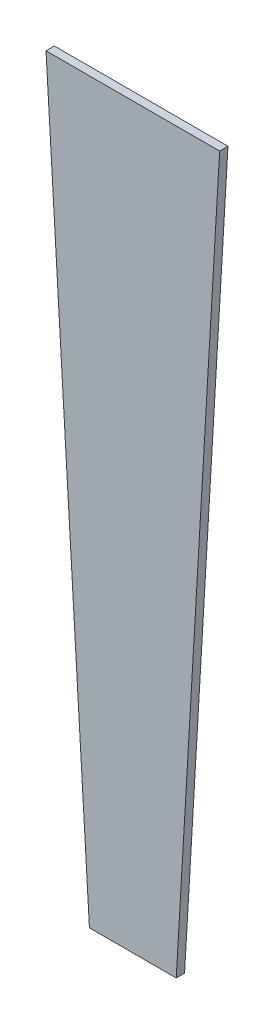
SolidWorks part; units mm, degrees
ref_plane "Front Plane" through (0, 0, 0) normal (0, 0, 1) x (1, 0, 0)
ref_plane "Top Plane" through (0, 0, 0) normal (0, 1, 0) x (1, 0, 0)
ref_plane "Right Plane" through (0, 0, 0) normal (1, 0, 0) x (0, 0, -1)
sketch "Sketch1" plane through (0, 0, 0) normal (0, 0, 1) x (1, 0, 0)
  line L0 (0, 0) -> (-25.4, 0)
  line L1 (-25.4, 0) -> (-19.05, -107.95)
  line L2 (-19.05, -107.95) -> (-6.35, -107.95)
  line L3 (-6.35, -107.95) -> (0, 0)
  point P3 (-12.7, 0)
  point P6 (-12.7, -107.95)
  dimension "D1" = 25.4
  dimension "D2" = 12.7
  dimension "D3" = 107.95
base flange "Base-Flange1" sketch "Sketch1" thickness 1.2192 reverse thickness direction no parameters "D1"=0.7366
sketch "Bend-Lines1" [suppressed] plane through (0, 0, 0) normal (0, 1, 0) x (1, 0, 0)
sketch "Bounding-Box1" [suppressed] plane through (0, 0, 0) normal (0, 1, 0) x (1, 0, 0)
sheet metal parameters "Sheet-Metal1" thickness 1.2192 parameters "D1"=0.7366
flat pattern "Flat-Pattern1"
sketch "Bend-Lines2" plane through (0, 0, 0) normal (0, 1, 0) x (1, 0, 0)
sketch3d "Bounding-Box2" [suppressed]
  line L0 (0, 0, 0) -> (0, -107.95, 0) construction
  line L1 (-25.4, 0, 0) -> (-25.4, -107.95, 0) construction
  line L2 (0, 0, 0) -> (-25.4, 0, 0) construction
  line L3 (0, -107.95, 0) -> (-25.4, -107.95, 0) construction
